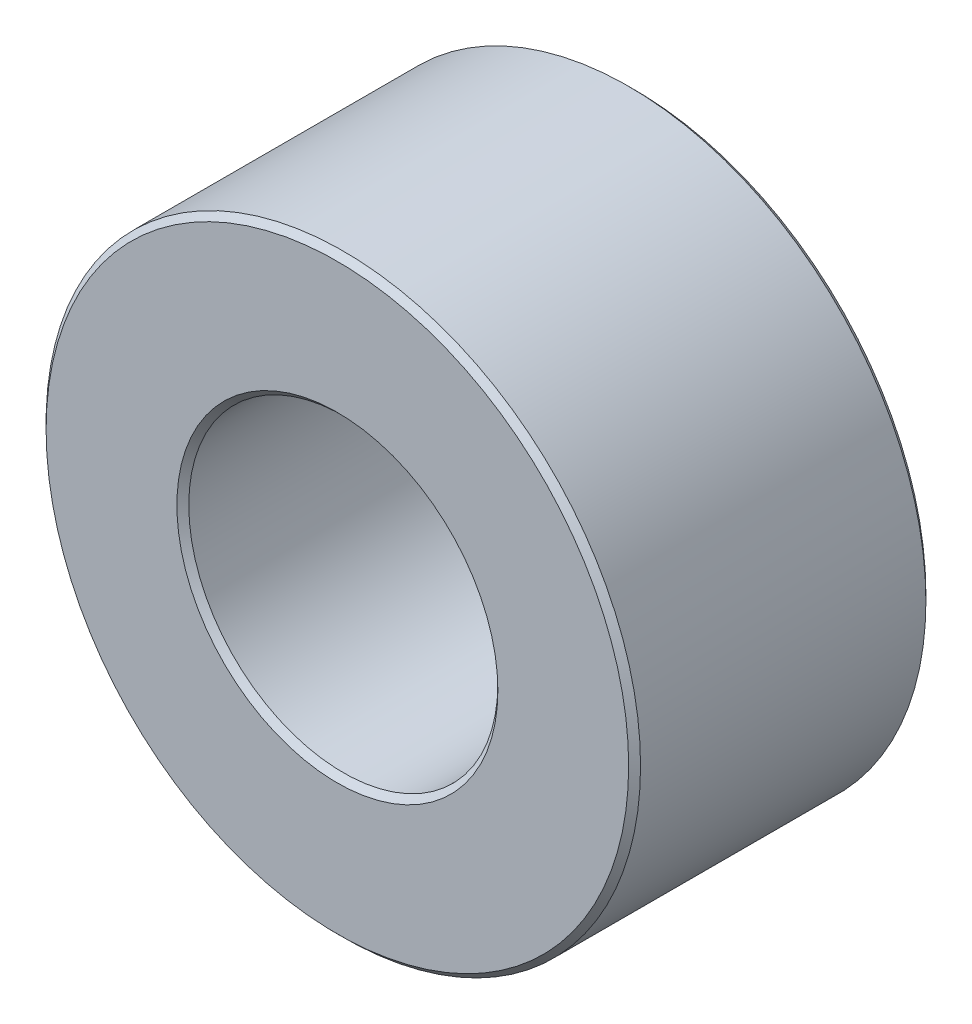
SolidWorks part; units mm, degrees
ref_plane "Front Plane" through (0, 0, 0) normal (0, 0, 1) x (1, 0, 0)
ref_plane "Top Plane" through (0, 0, 0) normal (0, 1, 0) x (1, 0, 0)
ref_plane "Right Plane" through (0, 0, 0) normal (1, 0, 0) x (0, 0, -1)
sketch "Sketch1" plane through (0, 0, 0) normal (0, 0, 1) x (1, 0, 0)
  circle A0 centre (0, 0) radius 5
  circle A1 centre (0, 0) radius 2.6
  dimension "D1" = 10
  dimension "D2" = 5.2
extrude "Boss-Extrude2" add sketch "Sketch1" along normal mid plane 5
chamfer "Chamfer3" distance 0.1 angle 45 4 edges at (5, 0, 2.5) (5, 0, -2.5) (2.6, 0, -2.5) (2.6, 0, 2.5)
